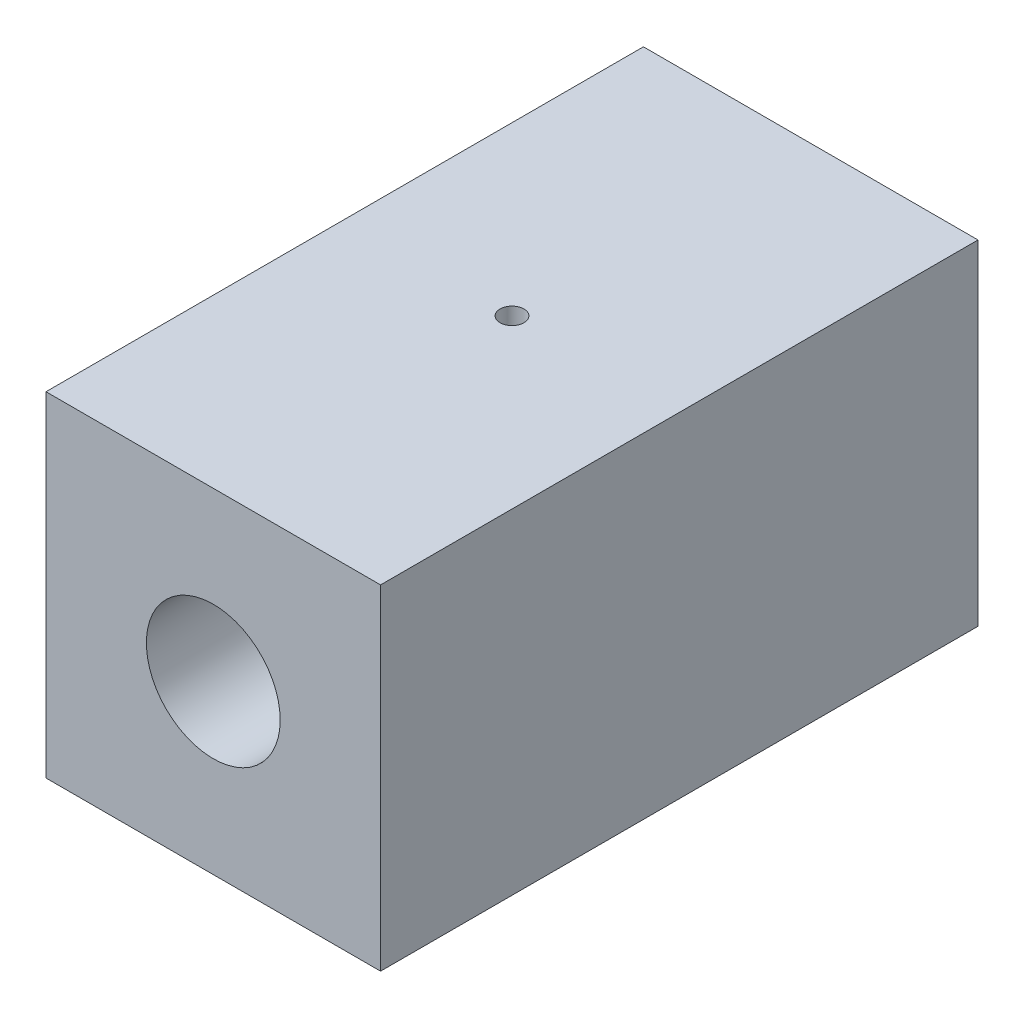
SolidWorks part; units mm, degrees
ref_plane "Face" through (0, 0, 0) normal (0, 0, 1) x (1, 0, 0)
ref_plane "Dessus" through (0, 0, 0) normal (0, 1, 0) x (1, 0, 0)
ref_plane "Droite" through (0, 0, 0) normal (1, 0, 0) x (0, 0, -1)
sketch "Esquisse1" plane through (0, 0, 0) normal (0, 0, 1) x (1, 0, 0)
  line L1 (0, 0) -> (70, 0)
  line L2 (0, 0) -> (0, -70)
  line L3 (0, -70) -> (70, -70)
  line L4 (70, 0) -> (70, -70)
  circle A0 centre (35, -35) radius 14
  dimension "D3" = 28
  dimension "D1" = 70
  dimension "D2" = 70
  dimension "D4" = 35
  dimension "D5" = 35
extrude "Base-Extrusion" add sketch "Esquisse1" along normal blind 125
sketch "Esquisse2" plane through (0, 0, 0) normal (0, 1, 0) x (-1, 0, 0)
  line L0 (-35, 125) -> (-35, 0) construction
  line L2 (-70, 0) -> (0, 0) construction
  circle A0 centre (-35, 62.5) radius 2.5
  dimension "D2" = 5
  dimension "D1" = 62.5
extrude "Enlèv. mat.-Extru.1" cut sketch "Esquisse2" against normal blind 35
